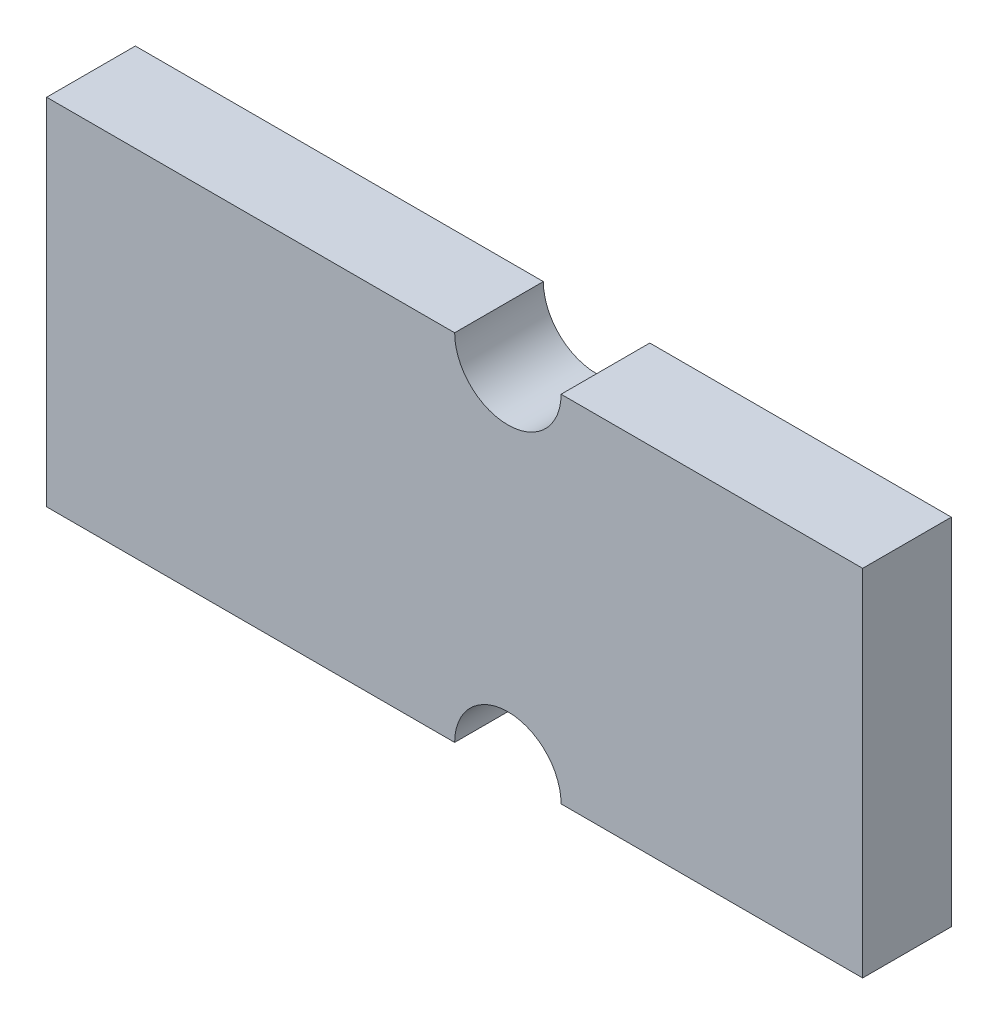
SolidWorks part; units mm, degrees
ref_plane "Front Plane" through (0, 0, 0) normal (0, 0, 1) x (1, 0, 0)
ref_plane "Top Plane" through (0, 0, 0) normal (0, 1, 0) x (1, 0, 0)
ref_plane "Right Plane" through (0, 0, 0) normal (1, 0, 0) x (0, 0, -1)
sketch "Sketch1" plane through (0, 0, 0) normal (0, 0, 1) x (1, 0, 0)
  line L0 (0, 0) -> (115, 0) construction
  line L1 (115, 50) -> (30, 50)
  line L2 (115, 50) -> (115, -50)
  line L3 (115, -50) -> (30, -50)
  line L4 (-115, 50) -> (-115, -50)
  line L5 (115, 50) -> (-115, -50) construction
  line L6 (115, -50) -> (-115, 50) construction
  line L7 (0, 50) -> (-115, 50)
  line L8 (0, -50) -> (-115, -50)
  arc A0 (30, 50) -> (0, 50) centre (15, 50) cw
  arc A1 (30, -50) -> (0, -50) centre (15, -50) ccw
  point P0 (0, 0)
  dimension "D3" = 15
  dimension "D1" = 100
  dimension "D2" = 230
  dimension "D4" = 130
extrude "Boss-Extrude1" add sketch "Sketch1" along normal mid plane 25
